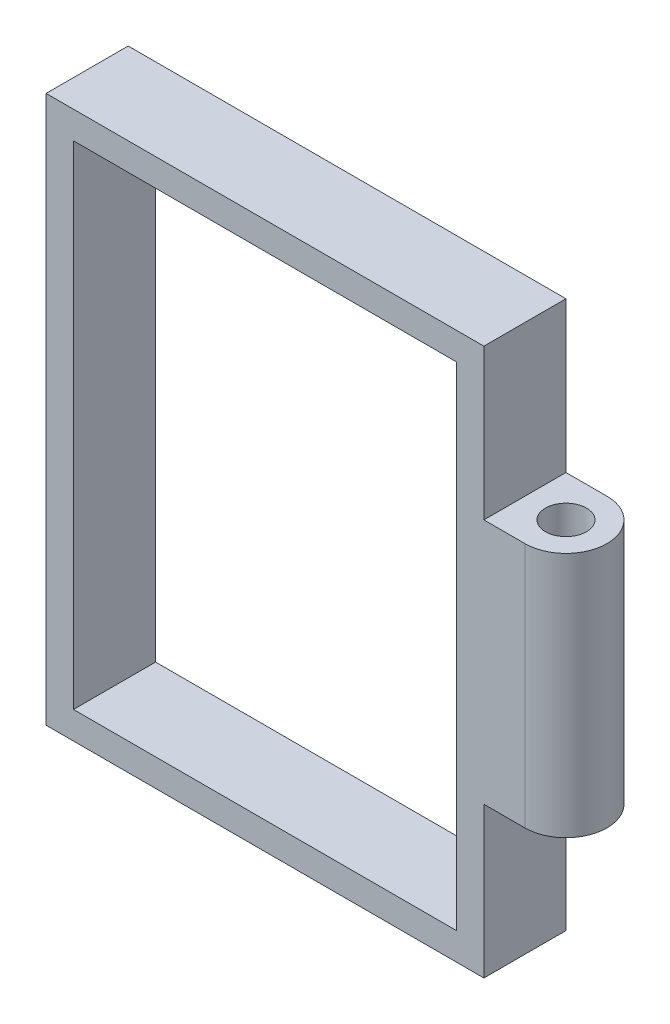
SolidWorks part; units mm, degrees
ref_plane "Alzado" through (0, 0, 0) normal (0, 0, 1) x (1, 0, 0)
ref_plane "Planta" through (0, 0, 0) normal (0, 1, 0) x (1, 0, 0)
ref_plane "Vista lateral" through (0, 0, 0) normal (1, 0, 0) x (0, 0, -1)
sketch "Croquis1" plane through (0, 0, 0) normal (0, 1, 0) x (1, 0, 0)
  line L1 (-8, -1.5) -> (8, -1.5)
  line L2 (-8, -1.5) -> (-8, 1.5)
  line L3 (-8, 1.5) -> (8, 1.5)
  line L4 (8, -1.5) -> (8, 1.5)
  line L5 (-8, -1.5) -> (8, 1.5) construction
  line L6 (-8, 1.5) -> (8, -1.5) construction
  point P0 (0, 0)
  dimension "D1" = 3
  dimension "D2" = 16
extrude "Saliente-Extruir1" add sketch "Croquis1" along normal blind 20
ref_plane "Plano1" through (0, 10, 0) normal (0, 1, 0) x (1, 0, 0)
sketch "Croquis3" plane through (0, 10, 0) normal (0, 1, 0) x (1, 0, 0)
  line L0 (8, 1.5) -> (11, -1.5) construction
  line L1 (8, 1.5) -> (11, 1.5) construction
  line L2 (8, 1.5) -> (8, -1.5)
  line L3 (8, -1.5) -> (11, -1.5) construction
  line L4 (11, 1.5) -> (11, -1.5) construction
  line L5 (8, 1.5) -> (9.5, 1.5)
  line L6 (8, -1.5) -> (9.5, -1.5)
  arc A0 (9.5, -1.5) -> (9.5, 1.5) centre (9.5, 0) ccw
  circle A1 centre (9.5, 0) radius 0.75
  dimension "D2" = 1.5
  dimension "D1" = 3
extrude "Saliente-Extruir2" add sketch "Croquis3" along normal blind 4.5 and the other way blind 4.5
sketch "Croquis5" plane through (0, 0, 1.5) normal (0, 0, 1) x (1, 0, 0)
  line L0 (2.2, 10) -> (-2.2, 10) construction
  line L1 (-7, 1) -> (7, 1)
  line L2 (-7, 1) -> (-7, 19)
  line L3 (-7, 19) -> (7, 19)
  line L4 (7, 1) -> (7, 19)
  line L5 (-7, 1) -> (7, 19) construction
  line L6 (-7, 19) -> (7, 1) construction
  point P0 (0, 10)
  dimension "D1" = 14
  dimension "D2" = 18
extrude "Cortar-Extruir2" cut sketch "Croquis5" against normal up to next
